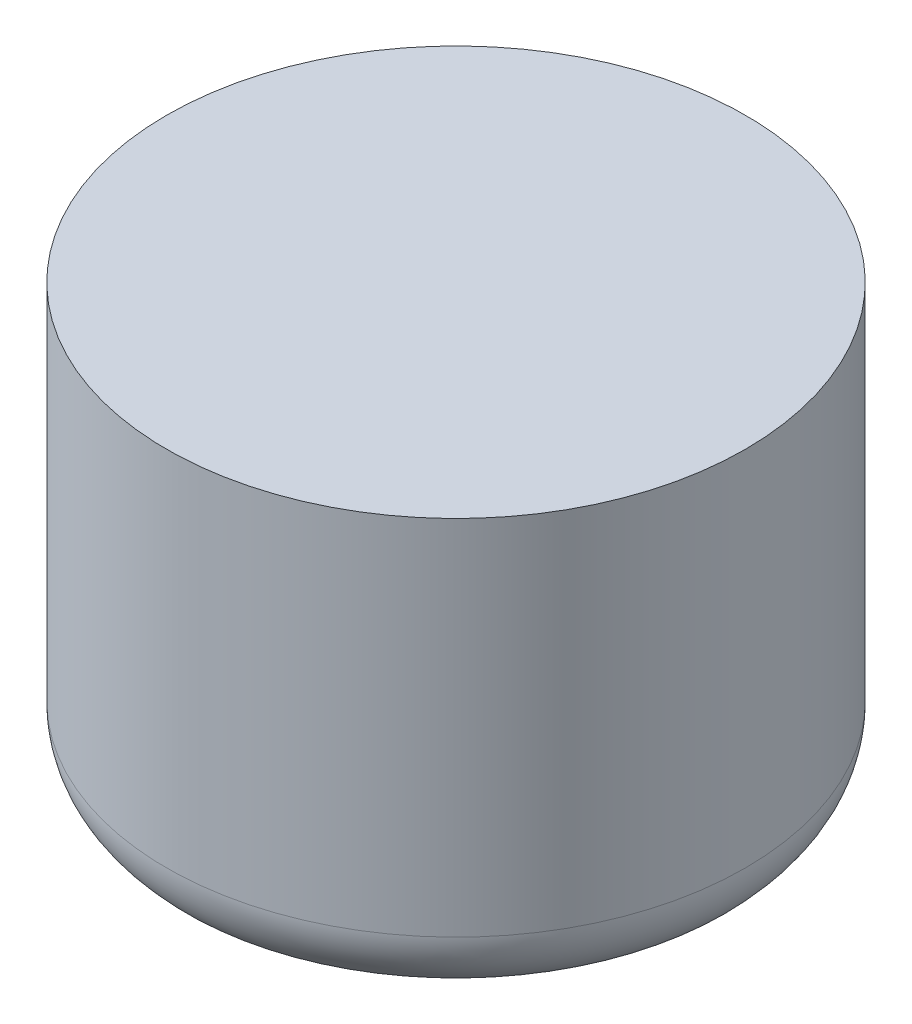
SolidWorks part; units mm, degrees
ref_plane "Plan de face" through (0, 0, 0) normal (0, 0, 1) x (1, 0, 0)
ref_plane "Plan de dessus" through (0, 0, 0) normal (0, 1, 0) x (1, 0, 0)
ref_plane "Plan de droite" through (0, 0, 0) normal (1, 0, 0) x (0, 0, -1)
sketch "Esquisse1" plane through (0, 0, 0) normal (0, 0, 1) x (1, 0, 0)
  line L0 (-120.0087, 54.6389) -> (-120.0087, 116.1489)
  line L1 (-70.9187, 164.8994) -> (-70.9187, 30.1746) construction
  line L2 (-120.0087, 116.1489) -> (-70.9187, 116.1489)
  line L3 (-116.4892, 46.1489) -> (-70.9187, 46.1489)
  line L4 (-70.9187, 46.1489) -> (-70.9187, 116.1489)
  arc A0 (-120.0087, 54.6389) -> (-116.4892, 46.1489) centre (-108.0087, 54.6389) ccw
  dimension "D1" = 49.09
  dimension "D2" = 12
  dimension "D4" = 70
  dimension "D3" = 8.49
revolve "Révolution1" add sketch "Esquisse1" angle 360 about L1
